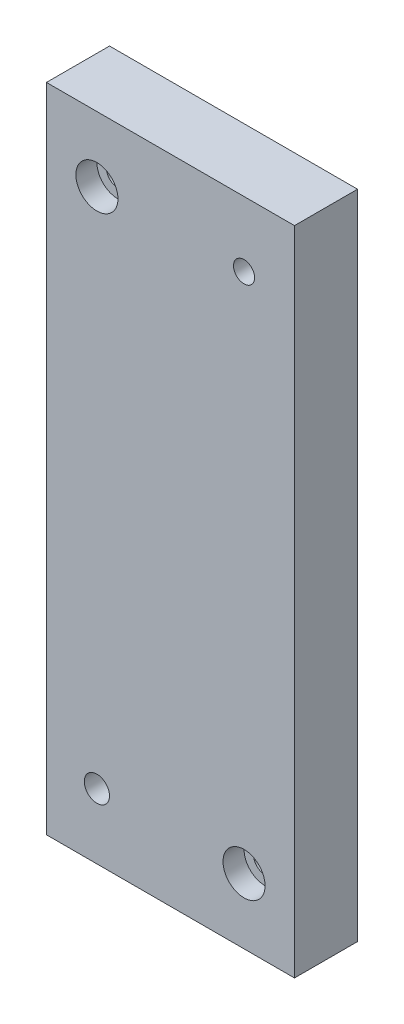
SolidWorks part; units mm, degrees
ref_plane "Plan de face" through (0, 0, 0) normal (0, 0, 1) x (1, 0, 0)
ref_plane "Plan de dessus" through (0, 0, 0) normal (0, 1, 0) x (1, 0, 0)
ref_plane "Plan de droite" through (0, 0, 0) normal (1, 0, 0) x (0, 0, -1)
sketch "Esquisse1" plane through (0, 0, 0) normal (0, 0, 1) x (1, 0, 0)
  line L0 (0, 115.0503) -> (0, -0.1136) construction
  line L1 (-30, -78) -> (-30, 78) construction
  line L2 (30, -78) -> (30, 78) construction
  line L3 (-29.5, -77.5) -> (-29.5, 77.5)
  line L4 (-30, 78) -> (4.5, 78) construction
  line L8 (29.5, -77.5) -> (29.5, 77.5)
  line L9 (-4.5, -78) -> (30, -78) construction
  line L40 (-29.5, -77.5) -> (29.5, -77.5)
  line L46 (29.5, 77.5) -> (-29.5, 77.5)
  circle A0 centre (-17.5, -62) radius 3.0035 construction
  circle A1 centre (17.5, 62) radius 2.5035 construction
  circle A2 centre (-17.5, -62) radius 3.0035
  circle A3 centre (17.5, 62) radius 2.5035
  dimension "D2" = 59
  dimension "D3" = 0.5
  dimension "D1" = 0.5
extrude "Extrusion1" add sketch "Esquisse1" along normal blind 15
hole_wizard "Chambrage pour vis à tête cylindrique à 6 pans creux (ou vis CHC) M51" positions "Esquisse3" profile "Esquisse2" counterbore size "M5" standard "Ansi Métrique"
sketch "Esquisse3" plane through (0, 0, 15) normal (0, 0, 1) x (1, 0, 0)
  point P0 (-17.5, 62)
  point P1 (17.5, -62)
sketch "Esquisse2" plane through (-17.5, 62, 15) normal (1, 0, 0) x (0, -1, 0)
  line L0 (0, 0) -> (0, 15)
  line L1 (0, 15) -> (2.75, 15)
  line L3 (2.75, 15) -> (2.75, 5)
  line L4 (2.75, 5) -> (5, 5)
  line L5 (5, 5) -> (5, 0)
  line L7 (5, 0) -> (0, 0)
  line L11 (0, -6.35) -> (0, 107.95) construction
  dimension "Diamètre du perçage jusqu'au prochain" = 5.5
  dimension "Profondeur du perçage jusqu'au prochain" = 15
  dimension "Diamètre du chambrage" = 10
  dimension "Profondeur du chambrage" = 5
